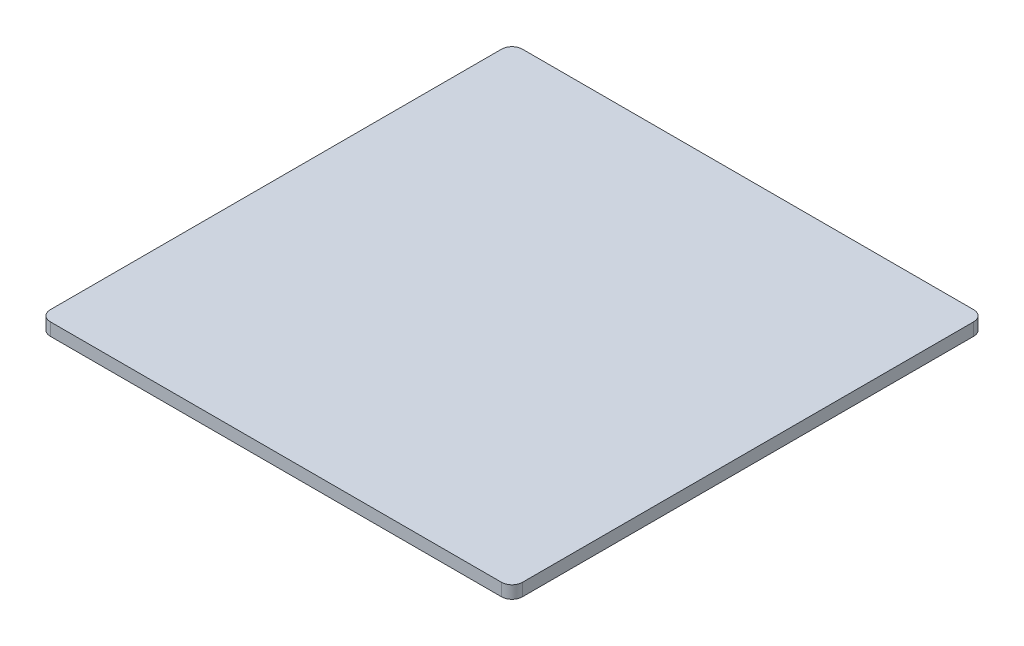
SolidWorks part; units mm, degrees
ref_plane "Front Plane" through (0, 0, 0) normal (0, 0, 1) x (1, 0, 0)
ref_plane "Top Plane" through (0, 0, 0) normal (0, 1, 0) x (1, 0, 0)
ref_plane "Right Plane" through (0, 0, 0) normal (1, 0, 0) x (0, 0, -1)
sketch "Sketch1" plane through (0, 0, 0) normal (0, 1, 0) x (1, 0, 0)
  line L1 (-225, 225) -> (225, 225)
  line L2 (-225, 225) -> (-225, -225)
  line L3 (-225, -225) -> (225, -225)
  line L4 (225, 225) -> (225, -225)
  line L5 (-225, 225) -> (225, -225) construction
  line L6 (-225, -225) -> (225, 225) construction
  point P0 (0, 0)
  dimension "D1" = 450
  dimension "D2" = 450
extrude "Boss-Extrude1" add sketch "Sketch1" against normal blind 12
fillet "Fillet1" radius 10 4 edges at (225, -6, -225) (225, -6, 225) (-225, -6, 225) (-225, -6, -225)
